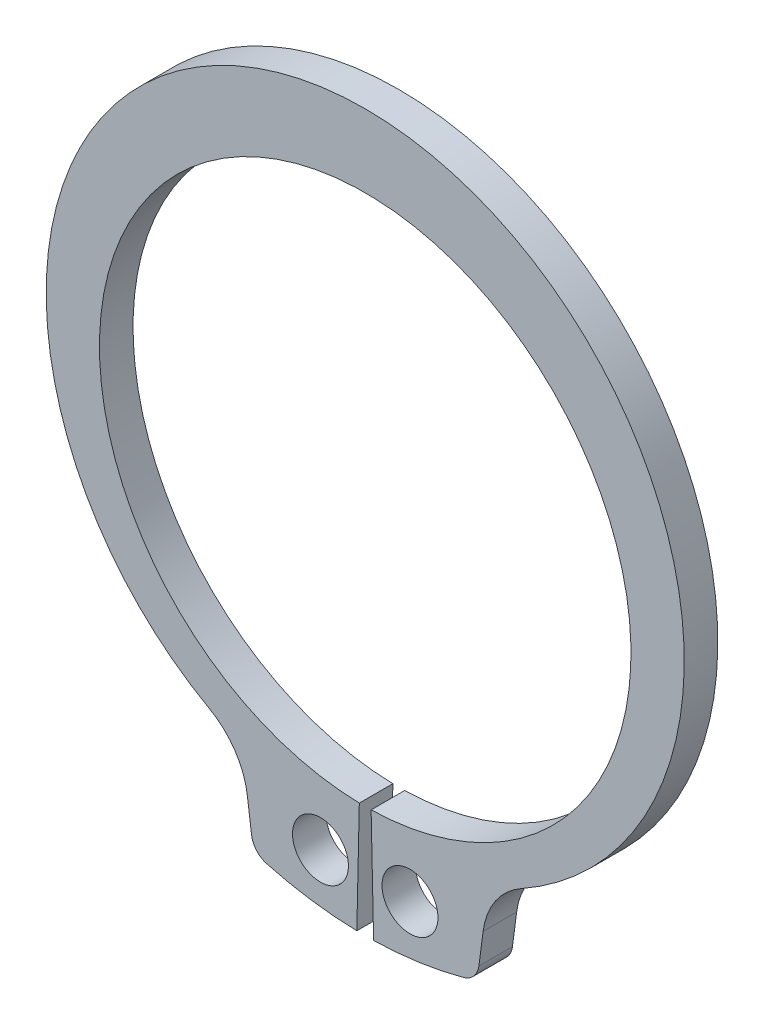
SolidWorks part; units mm, degrees
ref_plane "Plane1" through (0, 0, 0) normal (0, 0, 1) x (1, 0, 0)
ref_plane "Plane2" through (0, 0, 0) normal (0, 1, 0) x (1, 0, 0)
ref_plane "Plane3" through (0, 0, 0) normal (1, 0, 0) x (0, 0, -1)
extrude "Body" add sketch "BodySke" against normal blind 1.2
sketch "BodySke" plane through (0, 0, 0) normal (0, 0, 1) x (1, 0, 0)
  line L0 (-1.5431, 0) -> (1.5431, 0) construction
  line L1 (0, 0) -> (0, 12.1) construction
  line L2 (0.2111, -9.4977) -> (0.3, -13.4967)
  line L3 (-0.2111, -9.4977) -> (-0.3, -13.4967)
  line L4 (0, 0) -> (6.8901, -11.6093) construction
  line L5 (0, 0) -> (-6.8901, -11.6093) construction
  line L7 (4.2143, -11.257) -> (4.0627, -12.4083)
  line L8 (-4.2143, -11.257) -> (-4.0627, -12.4083)
  circle A0 centre (0, 0) radius 9.5 construction
  arc A1 (0.2111, -9.4977) -> (-0.2111, -9.4977) centre (0, 0) ccw
  arc A2 (5.5121, -9.2874) -> (-5.5121, -9.2874) centre (0, 0.696) ccw construction
  arc A3 (0.3, -13.4967) -> (3.5144, -13.0345) centre (0, 0) ccw
  arc A4 (5.5715, -9.2544) -> (4.2143, -11.257) centre (6.8901, -11.6093) ccw
  arc A5 (-4.2143, -11.257) -> (-5.5715, -9.2544) centre (-6.8901, -11.6093) ccw
  arc A6 (-3.5144, -13.0345) -> (-0.3, -13.4967) centre (0, 0) ccw
  arc A7 (5.5715, -9.2544) -> (-5.5715, -9.2544) centre (0, 0.696) ccw
  arc A8 (-4.2543, -10.9528) -> (4.2543, -10.9528) centre (0, 0) ccw construction
  circle A9 centre (1.6, -11.6406) radius 1
  circle A10 centre (-1.6, -11.6406) radius 1
  arc A11 (4.0627, -12.4083) -> (3.5144, -13.0345) centre (3.3191, -12.3104) cw
  arc A12 (-4.0627, -12.4083) -> (-3.5144, -13.0345) centre (-3.3191, -12.3104) ccw
  point P28 (3.9988, -12.8942)
  point P31 (-3.9988, -12.8942)
  dimension "GrooveDia" = 19
  dimension "D3" = 0.75
  dimension "LugRad" = 13.5
  dimension "HoleOffsetRad" = 11.75
  dimension "HoleDia" = 2
  dimension "D2" = 15
  dimension "LargeRad" = 12.1
  dimension "SmallRad" = 10.8
  dimension "Gap" = 0.6
  dimension "SmallAngle" = 61.378
  dimension "HoleSpacing" = 3.2
sketch "Clipboard" plane through (0, 0, 0) normal (0, 0, 1) x (1, 0, 0)
  line L0 (0, 0) -> (2.6, 0)
  line L1 (0, 0) -> (0, 1.3)
  line L2 (0, 0) -> (0, -4)
  circle A0 centre (0, 0) radius 1
  circle A1 centre (0, 0) radius 10
  dimension "HoleDia" = 2
  dimension "ShaftDia" = 20
  dimension "LargeSection" = 2.6
  dimension "SmallSection" = 1.3
  dimension "LugSection" = 4
sketch "NotSke" plane through (0, 0, 0) normal (0, 0, 1) x (1, 0, 0)
  line L0 (1.6, -10.6406) -> (1.6, -12.6406)
  line L1 (1.6, -12.6406) -> (-1.6, -12.6406)
  line L2 (-1.6, -12.6406) -> (-1.6, -10.6406)
  line L3 (-1.6, -10.6406) -> (1.6, -10.6406)
  circle A0 centre (1.6, -11.6406) radius 1 construction
  circle A1 centre (-1.6, -11.6406) radius 1 construction
extrude "Notch" [suppressed] cut sketch "NotSke" against normal through all
sketch "UnlSke" plane through (0, 0, 0) normal (0, 0, 1) x (1, 0, 0)
  line L0 (-2.9699, -13.1693) -> (-2.0899, -9.2673)
  line L1 (2.9699, -13.1693) -> (2.0899, -9.2673)
  arc A0 (2.0899, -9.2673) -> (-2.0899, -9.2673) centre (0, 0) ccw
  arc A1 (2.9699, -13.1693) -> (-2.9699, -13.1693) centre (0, 0) ccw
  arc A2 (0.3, -13.4967) -> (3.5144, -13.0345) centre (0, 0) ccw construction
  arc A3 (0.2111, -9.4977) -> (-0.2111, -9.4977) centre (0, 0) ccw construction
  circle A4 centre (-1.6, -11.6406) radius 1 construction
  circle A5 centre (1.6, -11.6406) radius 1 construction
extrude "Unlug" [suppressed] add sketch "UnlSke" against normal through all
equation "' \"ShaftDia@Clipboard\" = 3"
equation "' \"Thickness@Body\" = 0.4"
equation "' \"GrooveDia@BodySke\" = 2.8"
equation "' \"LugSection@Clipboard\" = 1.9"
equation "' \"LargeSection@Clipboard\" = 0.8"
equation "' \"HoleDia@Clipboard\" = 1.0"
equation "' \"ShaftDia@Clipboard\" = 10"
equation "' \"Thickness@Body\" = 1.0"
equation "' \"GrooveDia@BodySke\" = 9.6"
equation "' \"LugSection@Clipboard\" = 3.3"
equation "' \"LargeSection@Clipboard\" = 1.8"
equation "' \"HoleDia@Clipboard\" = 1.5"
equation "\"SmallSection@Clipboard\" = \"LargeSection@Clipboard\" * 0.5"
equation "\"Gap@BodySke\" =  \"Thickness@Body\" / 2"
equation "\"LargeRad@BodySke\" =  \"GrooveDia@BodySke\" / 2 +  \"LargeSection@Clipboard\""
equation "\"SmallRad@BodySke\" =  \"GrooveDia@BodySke\" / 2 +  \"SmallSection@Clipboard\""
equation "\"LugRad@BodySke\" = \"GrooveDia@BodySke\" / 2 + \"LugSection@Clipboard\""
equation "\"HoleOffsetRad@BodySke\" = (  \"ShaftDia@Clipboard\" / 2 + \"LugRad@BodySke\" ) / 2"
equation "\"HoleSpacing@BodySke\" = \"Gap@BodySke\"  * 2 +  \"HoleDia@Clipboard\""
equation "\"HoleDia@BodySke\" =  \"HoleDia@Clipboard\""
equation "\"SmallAngle@BodySke\" = atn(\"HoleSpacing@BodySke\" / 2 / sqr(\"HoleOffsetRad@BodySke\"  * \"HoleOffsetRad@BodySke\" - (\"HoleSpacing@BodySke\" / 2) * (\"HoleSpacing@BodySke\" / 2) ))  * 7 *  (\"LargeRad@BodySke\""
